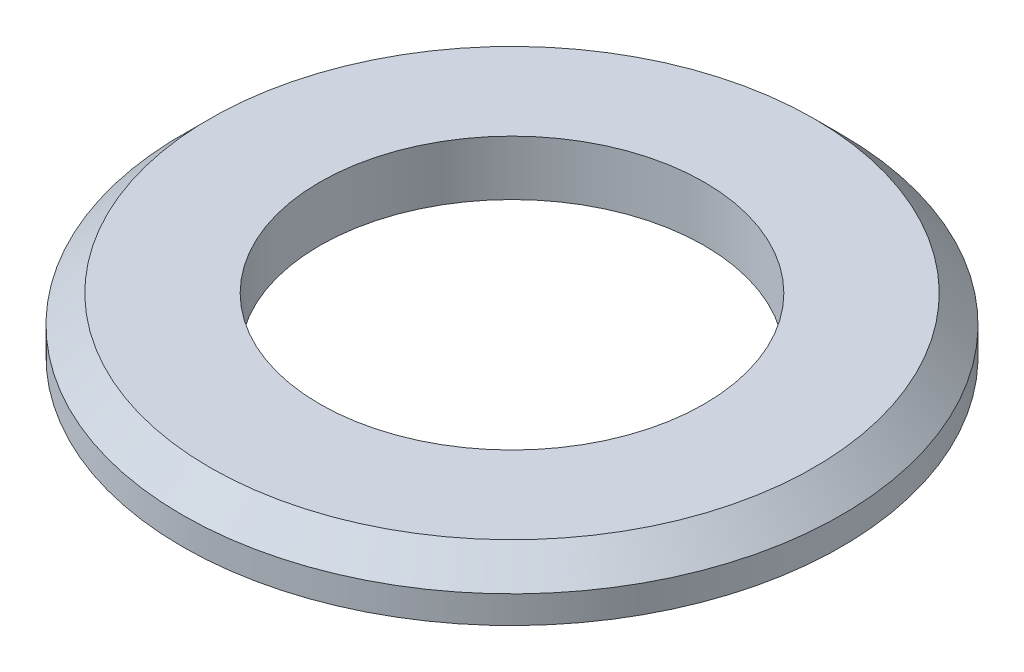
SolidWorks part; units mm, degrees
ref_plane "Front" through (0, 0, 0) normal (0, 0, 1) x (1, 0, 0)
ref_plane "Top" through (0, 0, 0) normal (0, 1, 0) x (1, 0, 0)
ref_plane "Right" through (0, 0, 0) normal (1, 0, 0) x (0, 0, -1)
sketch "Sketch1" plane through (0, 0, 0) normal (0, 1, 0) x (1, 0, 0)
  circle A0 centre (0, 0) radius 35
  circle A1 centre (0, 0) radius 60
extrude "Extrude1" add sketch "Sketch1" along normal blind 10
chamfer "Chamfer1" distance 5 1 edges at (0, 10, 60)
